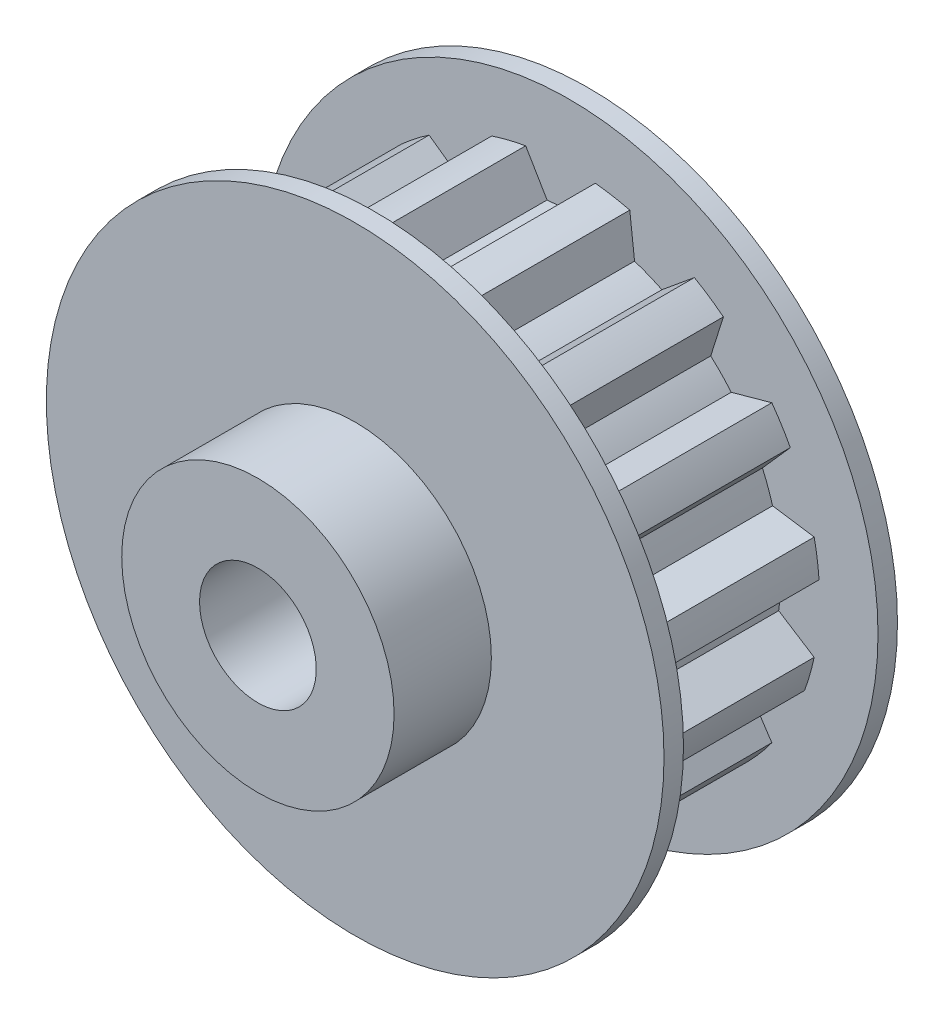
SolidWorks part; units mm, degrees
ref_plane "Front Plane" through (0, 0, 0) normal (0, 0, 1) x (1, 0, 0)
ref_plane "Top Plane" through (0, 0, 0) normal (0, 1, 0) x (1, 0, 0)
ref_plane "Right Plane" through (0, 0, 0) normal (1, 0, 0) x (0, 0, -1)
imported_body "Imported3"
sketch "Sketch1" plane through (0, 0, 12) normal (0, 0, 1) x (1, 0, 0)
  circle A0 centre (0, 0) radius 7
extrude "Boss-Extrude1" add sketch "Sketch1" along normal blind 5
hole_wizard "Hole1" positions "Sketch3" profile "Sketch2" legacy
sketch "Sketch3" plane through (0, 0, 0) normal (0, 0, -1) x (-1, 0, 0)
  point P0 (0, 0)
sketch "Sketch2" plane through (0, 0, 0) normal (1, 0, 0) x (0, 1, 0)
  line L0 (0, 0) -> (0, 17)
  line L1 (0, 17) -> (3, 17)
  line L2 (3, 17) -> (3, 0)
  line L3 (3, 0) -> (0, 0)
  line L4 (0, 110) -> (0, -10) construction
  dimension "Diameter" = 6
  dimension "Depth" = 17
